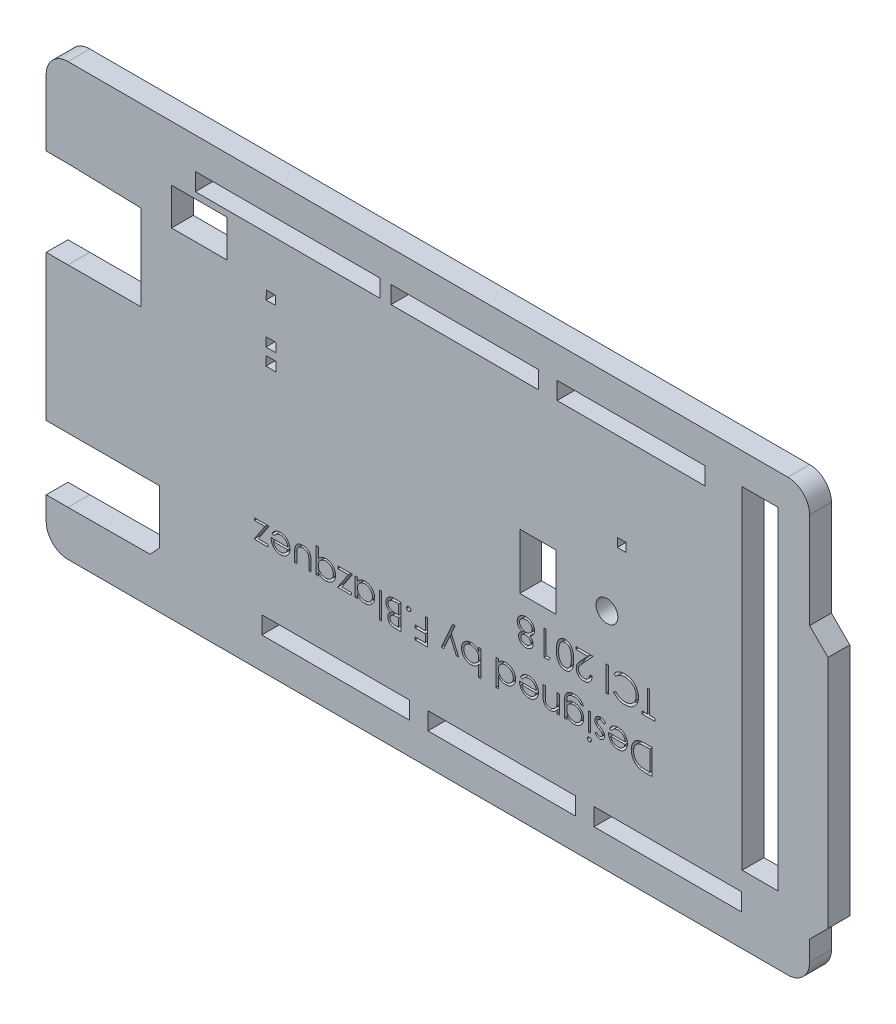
SolidWorks part; units mm, degrees
ref_plane "Front Plane" through (0, 0, 0) normal (0, 0, 1) x (1, 0, 0)
ref_plane "Top Plane" through (0, 0, 0) normal (0, 1, 0) x (1, 0, 0)
ref_plane "Right Plane" through (0, 0, 0) normal (1, 0, 0) x (0, 0, -1)
body saved out of another part "Stock-Base-1"
